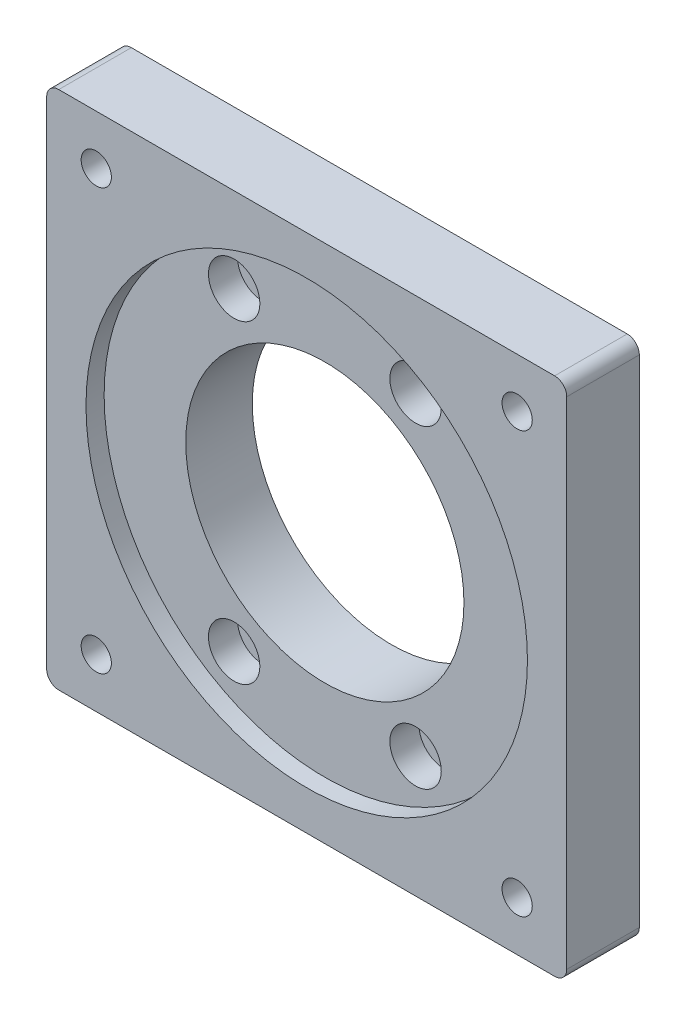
SolidWorks part; units mm, degrees
ref_plane "前视基准面" through (0, 0, 0) normal (0, 0, 1) x (1, 0, 0)
ref_plane "上视基准面" through (0, 0, 0) normal (0, 1, 0) x (1, 0, 0)
ref_plane "右视基准面" through (0, 0, 0) normal (1, 0, 0) x (0, 0, -1)
sketch "草图1" plane through (0, 0, 0) normal (0, 0, 1) x (1, 0, 0)
  line L1 (-43, -43) -> (43, -43)
  line L2 (-43, -43) -> (-43, 43)
  line L3 (-43, 43) -> (43, 43)
  line L4 (43, -43) -> (43, 43)
  line L5 (-43, -43) -> (43, 43) construction
  line L6 (-43, 43) -> (43, -43) construction
  circle A0 centre (0, 0) radius 23
  point P0 (0, 0)
  dimension "D3" = 46
  dimension "D1" = 86
  dimension "D2" = 86
extrude "凸台-拉伸1" add sketch "草图1" along normal blind 12
sketch "草图2" plane through (0, 0, 12) normal (0, 0, 1) x (1, 0, 0)
  line L0 (0, 43) -> (0, 0) construction
  line L1 (43, 43) -> (-43, 43) construction
  line L2 (0, 0) -> (-43, 0) construction
  line L3 (-43, 43) -> (-43, -43) construction
  circle A0 centre (-34.8, 34.8) radius 2.1
  circle A1 centre (34.8, 34.8) radius 2.1
  circle A2 centre (34.8, -34.8) radius 2.1
  circle A3 centre (-34.8, -34.8) radius 2.1
  dimension "D1" = 69.6
  dimension "D2" = 69.6
  dimension "D3" = 4.2
extrude "切除-拉伸1" cut sketch "草图2" against normal through all
sketch "草图3" plane through (0, 0, 12) normal (0, 0, 1) x (1, 0, 0)
  circle A0 centre (0, 0) radius 36.5
  dimension "D1" = 73
extrude "切除-拉伸2" cut sketch "草图3" against normal blind 3
sketch "草图5" plane through (0, 0, 9) normal (0, 0, 1) x (1, 0, 0)
  line L0 (0, 30) -> (0, 0) construction
  line L1 (0, 0) -> (-30, 0) construction
  line L2 (-15, 25.9808) -> (15, -25.9808) construction
  line L3 (15, 25.9808) -> (-15, -25.9808) construction
  circle A0 centre (0, 0) radius 30 construction
  circle A1 centre (-15, 25.9808) radius 2.25
  circle A2 centre (15, 25.9808) radius 2.25
  circle A3 centre (15, -25.9808) radius 2.25
  circle A4 centre (-15, -25.9808) radius 2.25
  dimension "D3" = 60
  dimension "D4" = 4.5
  dimension "D1" = 30
  dimension "D2" = 30
extrude "切除-拉伸3" cut sketch "草图5" against normal through all
sketch "草图6" plane through (0, 0, 9) normal (0, 0, 1) x (1, 0, 0)
  circle A0 centre (-15, 25.9808) radius 4.25
  circle A1 centre (15, 25.9808) radius 4.25
  circle A2 centre (15, -25.9808) radius 4.25
  circle A3 centre (-15, -25.9808) radius 4.25
  dimension "D1" = 8.5
extrude "切除-拉伸4" cut sketch "草图6" against normal blind 4.8
fillet "圆角1" radius 2 4 edges at (-43, 43, 6) (-43, -43, 6) (43, -43, 6) (43, 43, 6)
sketch "草图7" plane through (0, 0, 0) normal (0, 0, -1) x (-1, 0, 0)
  circle A0 centre (0, 0) radius 23 construction
  circle A1 centre (0, 0) radius 23
  circle A2 centre (0, 0) radius 25
  dimension "D1" = 50
extrude "凸台-拉伸2" add sketch "草图7" along normal blind 2
hole_wizard "M6 螺纹孔5" positions "草图11" profile "草图10" tap size "M6" standard "GB"
sketch "草图11" plane through (0, 0, 12) normal (0, 0, 1) x (1, 0, 0)
  point P0 (-34.8, -34.8)
  point P3 (-34.8, 34.8)
  point P6 (34.8, 34.8)
  point P9 (34.8, -34.8)
sketch "草图10" plane through (-34.8, -34.8, 12) normal (1, 0, 0) x (0, -1, 0)
  line L0 (0, 0) -> (0, 16.5022)
  line L1 (0, 16.5022) -> (2.5, 15)
  line L2 (2.5, 15) -> (2.5, 0)
  line L5 (2.5, 0) -> (0, 0)
  line L10 (0, 16.5022) -> (-2.5, 15) construction
  line L11 (0, -6.35) -> (0, 107.95) construction
  dimension "螺纹孔钻头直径" = 5
  dimension "螺纹孔钻头深度" = 15
  dimension "导头角度" = 118
